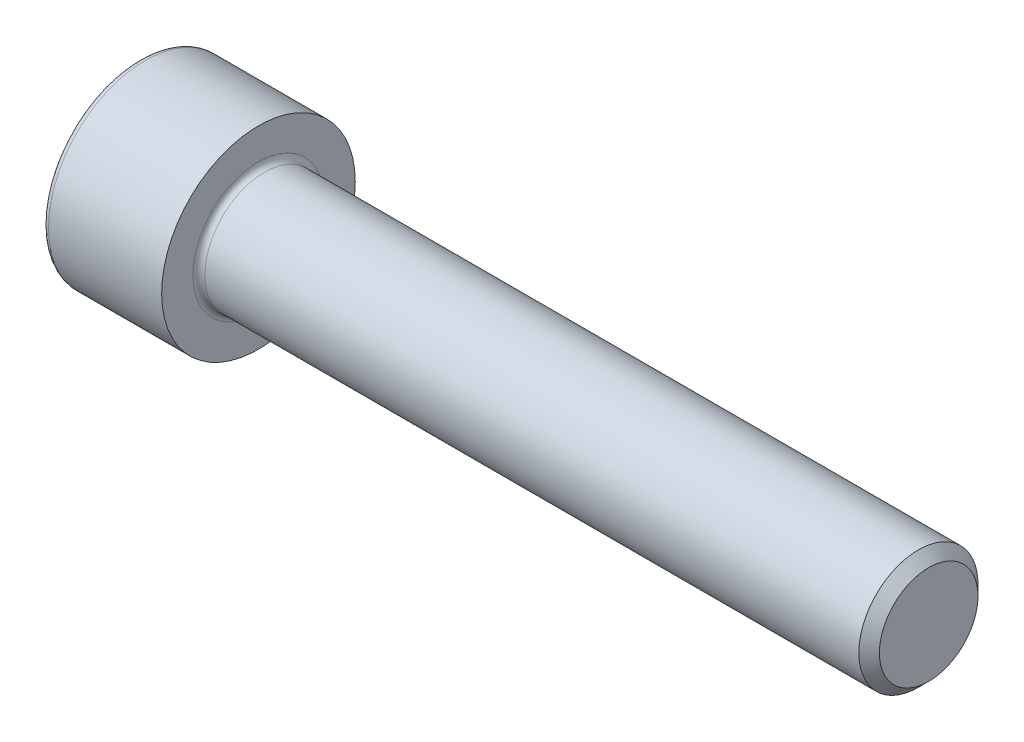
SolidWorks part; units mm, degrees
ref_plane "Plane1" through (0, 0, 0) normal (0, 0, 1) x (1, 0, 0)
ref_plane "Plane2" through (0, 0, 0) normal (0, 1, 0) x (1, 0, 0)
ref_plane "Plane3" through (0, 0, 0) normal (1, 0, 0) x (0, 0, -1)
sketch "BodySke" plane through (0, 0, 0) normal (0, 0, 1) x (1, 0, 0)
  line L0 (0, 0) -> (0, 6.5)
  line L1 (0, 6.5) -> (8, 6.5)
  line L2 (8, 6.5) -> (8, 4)
  line L3 (8, 4) -> (52.3095, 4)
  line L4 (53, 3.3095) -> (53, 0)
  line L5 (53, 0) -> (0, 0)
  line L6 (-31.75, 0) -> (127, 0) construction
  line L8 (53, 3.3095) -> (52.3095, 4)
  line L10 (53, -3.3095) -> (52.3095, -4) construction
  line L11 (9.25, 9.525) -> (9.25, 3.175) construction
  line L12 (8, 9.525) -> (8, 3.175) construction
  line L13 (-7, 9.525) -> (-7, 3.175) construction
  dimension "Diameter" = 8
  dimension "Head_ht" = 8
  dimension "Length" = 45
  dimension "Body_ch_ang" = 45
  dimension "Head_dia" = 13
  dimension "Minor_dia" = 6.619
  dimension "Advance" = 1.25
  dimension "Thread_nom" = 45
  dimension "Thread_length" = 60
revolve "Base-Revolve" add sketch "BodySke"
fillet "Fillet1" radius 0.4 1 edges at (8, 0, 4)
fillet "Fillet2" radius 0.4 1 edges at (0, 0, 6.5)
sketch "Sketch2" plane through (0, 0, 0) normal (0, 0, 1) x (1, 0, 0)
  line L0 (0, 3.0475) -> (4, 3.0475)
  line L1 (4, 3.0475) -> (5.7595, 0)
  line L2 (-31.75, 0) -> (127, 0) construction
  line L3 (5.7595, 0) -> (0, 0)
  line L4 (0, 0) -> (0, 3.0475)
  line L6 (0, 0) -> (47.625, 0) construction
  dimension "D1" = 3.0475
  dimension "D2" = 60
  dimension "Depth" = 4
revolve "Hex-PreBroach" cut sketch "Sketch2" angle 360 about L6
sketch "Sketch3" plane through (0, 0, 0) normal (-1, 0, 0) x (0, 0.5, 0.866)
  line L0 (1.7595, 3.0475) -> (-1.7595, 3.0475)
  line L1 (-1.7595, 3.0475) -> (-3.5189, 0)
  line L2 (1.7595, 3.0475) -> (3.5189, 0)
  line L3 (1.7595, -3.0475) -> (3.5189, 0)
  line L4 (1.7595, -3.0475) -> (-1.7595, -3.0475)
  line L5 (-1.7595, -3.0475) -> (-3.5189, 0)
  dimension "D1" = 3.0475
  dimension "D2" = 3.0475
  dimension "Hex_size" = 6.095
extrude "Hex" cut sketch "Sketch3" against normal blind 4
sketch "ThdSchSke" plane through (0, 0, 0) normal (0, 0, 1) x (1, 0, 0)
  line L0 (11.75, -3.3095) -> (11.2665, -4)
  line L1 (11.75, -3.3095) -> (12.2335, -4)
  line L2 (12.2335, -4) -> (12.2335, -5)
  line L3 (-3.175, 0) -> (5.1513, 0) construction
  line L4 (0, 6.1) -> (0, -6.1) construction
  line L5 (12.2335, -5) -> (11.2665, -5)
  line L6 (11.2665, -5) -> (11.2665, -4)
  dimension "Thread_minor" = 6.619
  dimension "Diameter" = 8
  dimension "Start" = 11.75
  dimension "SideAngle" = 55
  dimension "VeeAngle" = 70
  dimension "Overcut" = 10
revolve "ThreadSchematic" [suppressed] cut sketch "ThdSchSke" angle 360 about L3
pattern_linear "ThdSchPat" [suppressed]
equation "\"D2@Sketch3\" = \"Hex_size@Sketch3\" / 2"
equation "\"D1@Sketch3\" = \"Hex_size@Sketch3\" / 2"
equation "\"D1@Sketch2\" = \"Hex_size@Sketch3\" / 2"
equation "\"Thread_minor@ThreadCosmetic\"  =  \"Minor_dia@BodySke\""
equation "\"Depth@Sketch2\" =  \"Key_eng@Hex\""
equation "\"Thread_length@ThreadCosmetic\" = ((sgn( (\"Length@BodySke\" - \"Advance@BodySke\" * 3.0) - \"Thread_nom@BodySke\" )-1)*( (\"Length@BodySke\" - \"Advance@BodySke\" * 3.0) - \"Thread_nom@BodySke\" ))/-2+ \"Thread_no"
equation "\"Thread_minor@ThdSchSke\" = \"Minor_dia@BodySke\""
equation "\"Diameter@ThdSchSke\" = \"Diameter@BodySke\""
equation "\"Overcut@ThdSchSke\" = \"Diameter@BodySke\" * 1.25"
equation "\"Start@ThdSchSke\" = \"Head_ht@BodySke\" + \"Length@BodySke\" - \"Thread_length@ThreadCosmetic\"  '---Non-countersunk---"
equation "\"Num_threads@ThdSchPat\" = int( \"Thread_length@ThreadCosmetic\" / \"Advance@BodySke\" + 0.999 )  + 1"
equation "\"Advance@ThdSchPat\" = \"Thread_length@ThreadCosmetic\" /  (\"Num_threads@ThdSchPat\" - 1) 'relax it"
equation "\"Num_threads@ThdSchPat\" = \"Num_threads@ThdSchPat\" - sgn( \"Num_threads@ThdSchPat\" - 1) '---chamfered tips only---"
